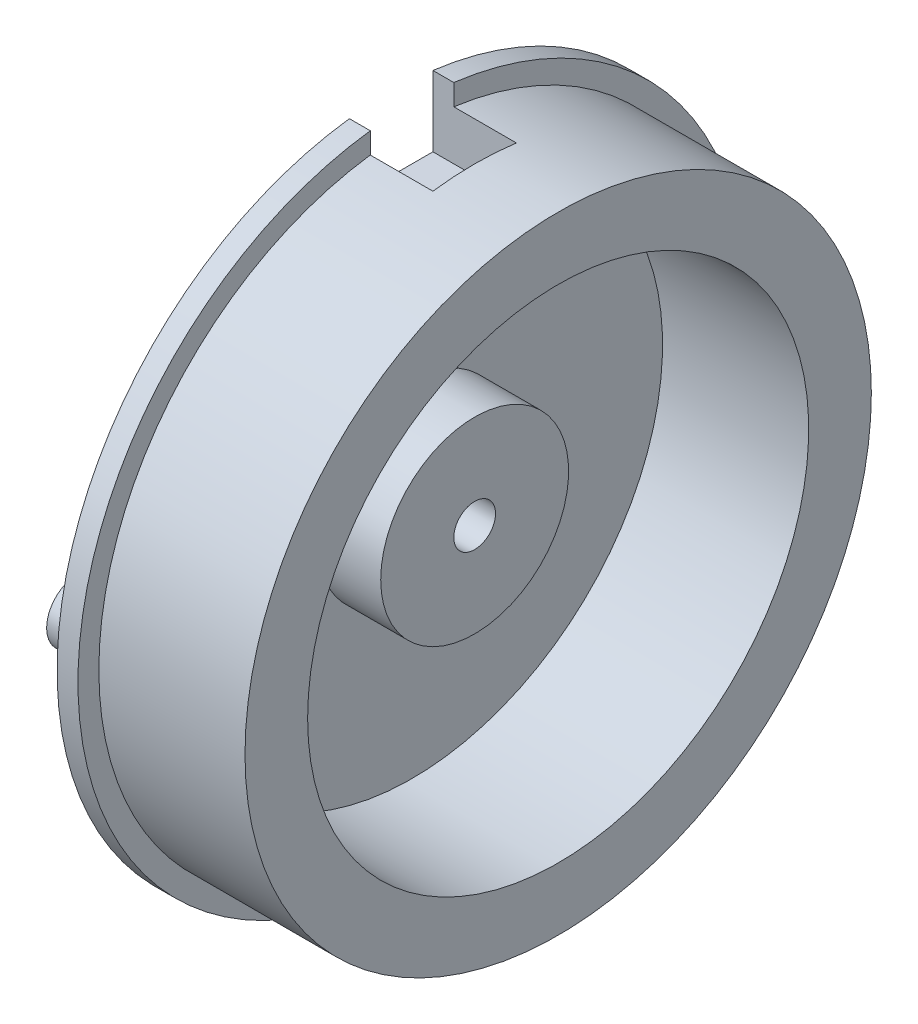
SolidWorks part; units mm, degrees
ref_plane "FACE" through (0, 0, 0) normal (0, 0, 1) x (1, 0, 0)
ref_plane "DESSUS" through (0, 0, 0) normal (0, 1, 0) x (1, 0, 0)
ref_plane "GAUCHE" through (0, 0, 0) normal (1, 0, 0) x (0, 0, -1)
sketch "Esquisse1" plane through (0, 0, 0) normal (0, 0, 1) x (1, 0, 0)
  line L0 (0, 0) -> (30, 0) construction
  line L1 (0, 4.5) -> (0, 16)
  line L2 (0, 16) -> (1, 16)
  line L3 (1, 16) -> (1, 15)
  line L4 (1, 15) -> (8, 15)
  line L5 (8, 15) -> (8, 12)
  line L6 (8, 12) -> (1, 12)
  line L7 (1, 12) -> (1, 4.5)
  line L8 (1, 4.5) -> (4, 4.5)
  line L9 (4, 4.5) -> (4, 1)
  line L10 (4, 1) -> (-1.5, 1)
  line L11 (-1.5, 1) -> (-1.5, 4.5)
  line L12 (-1.5, 4.5) -> (0, 4.5)
  line L13 (12.489, 0.1077) -> (42.489, 0.1077) construction
  dimension "D1" = 9
  dimension "D2" = 1
  dimension "D3" = 32
  dimension "D4" = 30
  dimension "D5" = 24
  dimension "D6" = 1.5
  dimension "D7" = 1
  dimension "D8" = 8
  dimension "D9" = 3
revolve "Base-Révolution" add sketch "Esquisse1" angle 360 about L0
sketch "Esquisse2" plane through (0, 0, 0) normal (-1, 0, 0) x (0, 0, 1)
  line L0 (-2, 15.8745) -> (-2, 12.5)
  line L1 (-2, 12.5) -> (2, 12.5)
  line L2 (2, 12.5) -> (2, 15.8745)
  circle A0 centre (0, 0) radius 16 construction
  arc A1 (2, 15.8745) -> (-2, 15.8745) centre (0, 0) ccw
  dimension "D1" = 12.5
  dimension "D2" = 4
  dimension "D3" = 2
extrude "Enlèv. mat.-Extru.1" cut sketch "Esquisse2" against normal blind 4
pattern_circular "Répétition circulaire1" count 2 every 180 about axis through (0, 0, 0) along (1, 0, 0)
sketch "Esquisse3" plane through (0, 0, 0) normal (-1, 0, 0) x (0, 0, 1)
  circle A0 centre (-6.5, 11.2583) radius 1 construction
  circle A1 centre (-6.5, 11.2583) radius 1
extrude "Boss.-Extru.1" add sketch "Esquisse3" along normal blind 1
sketch "Esquisse4" plane through (-1, 0, 0) normal (-1, 0, 0) x (0, 0, 1)
  circle A0 centre (-6.5, 11.2583) radius 1.5
  circle A1 centre (-6.5, 11.2583) radius 1 construction
  dimension "D1" = 3
extrude "Boss.-Extru.2" add sketch "Esquisse4" along normal blind 1
pattern_circular "Répétition circulaire2" count 3 every 120 about axis through (0, 0, 0) along (1, 0, 0)
